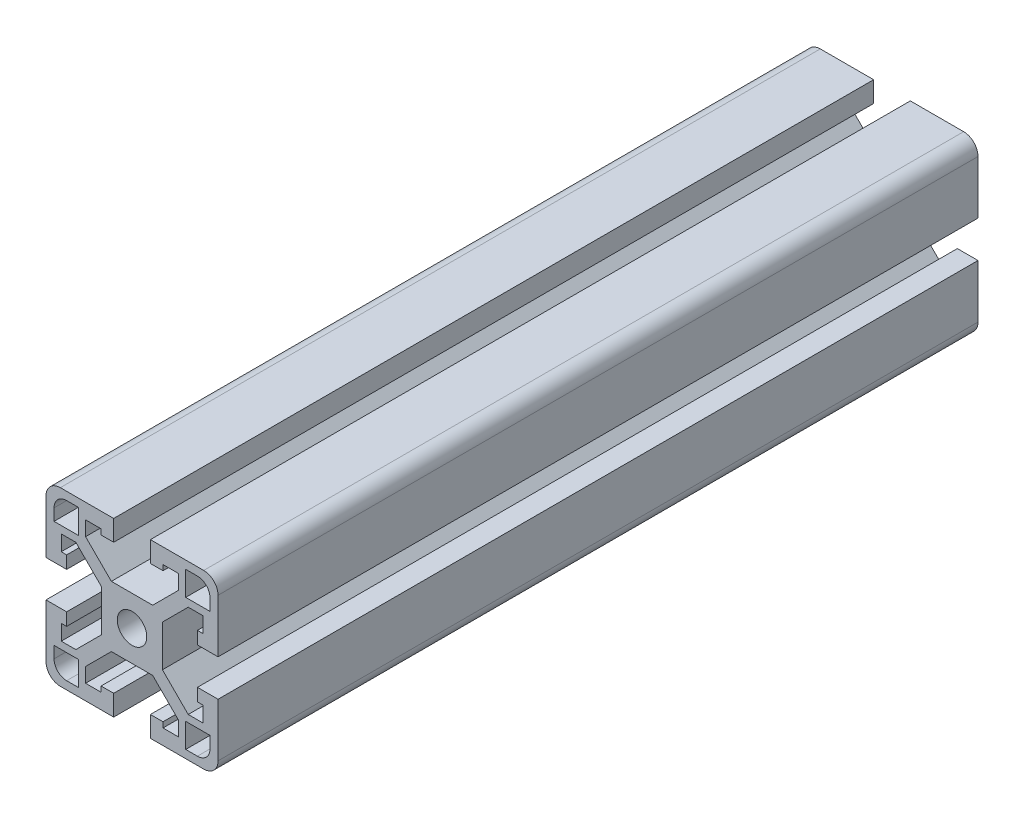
SolidWorks part; units mm, degrees
ref_plane "Front" through (0, 0, 0) normal (0, 0, 1) x (1, 0, 0)
ref_plane "Top" through (0, 0, 0) normal (0, 1, 0) x (1, 0, 0)
ref_plane "Right" through (0, 0, 0) normal (1, 0, 0) x (0, 0, -1)
sketch "Sketch1" plane through (0, 0, 0) normal (0, 0, 1) x (1, 0, 0)
  line L0 (-11.8872, 17.272) -> (-14.478, 17.272)
  line L1 (-11.8872, 11.8872) -> (-11.8872, 17.272)
  line L2 (-17.272, 11.8872) -> (-11.8872, 11.8872)
  line L3 (-17.272, 14.478) -> (-17.272, 11.8872)
  line L4 (14.478, 17.272) -> (11.8872, 17.272)
  line L5 (17.272, 11.8872) -> (17.272, 14.478)
  line L6 (11.8872, 11.8872) -> (17.272, 11.8872)
  line L7 (11.8872, 17.272) -> (11.8872, 11.8872)
  line L8 (11.8872, -17.272) -> (14.478, -17.272)
  line L9 (11.8872, -11.8872) -> (11.8872, -17.272)
  line L10 (17.272, -11.8872) -> (11.8872, -11.8872)
  line L11 (17.272, -14.478) -> (17.272, -11.8872)
  line L12 (-14.478, -17.272) -> (-11.8872, -17.272)
  line L13 (-17.272, -11.8872) -> (-17.272, -14.478)
  line L14 (-11.8872, -11.8872) -> (-17.272, -11.8872)
  line L15 (-11.8872, -17.272) -> (-11.8872, -11.8872)
  line L16 (-6.731, 4.5757) -> (-6.731, -4.5757)
  line L17 (-6.731, -4.5757) -> (-12.4423, -10.287)
  line L18 (-12.4423, -10.287) -> (-15.6718, -10.287)
  line L19 (-15.6718, -10.287) -> (-15.6718, -6.858)
  line L20 (-15.6718, -6.858) -> (-14.478, -6.858)
  line L21 (-14.478, -6.858) -> (-14.478, -4.064)
  line L22 (-14.478, -4.064) -> (-19.05, -4.064)
  line L23 (-19.05, -4.064) -> (-19.05, -15.875)
  line L24 (-15.875, -19.05) -> (-4.064, -19.05)
  line L25 (-4.064, -19.05) -> (-4.064, -14.478)
  line L26 (-4.064, -14.478) -> (-6.858, -14.478)
  line L27 (-6.858, -14.478) -> (-6.858, -15.6718)
  line L28 (-6.858, -15.6718) -> (-10.287, -15.6718)
  line L29 (-10.287, -15.6718) -> (-10.287, -12.4423)
  line L30 (-10.287, -12.4423) -> (-4.5757, -6.731)
  line L31 (-4.5757, -6.731) -> (4.5757, -6.731)
  line L32 (4.5757, -6.731) -> (10.287, -12.4423)
  line L33 (10.287, -12.4423) -> (10.287, -15.6718)
  line L34 (10.287, -15.6718) -> (6.858, -15.6718)
  line L35 (6.858, -15.6718) -> (6.858, -14.478)
  line L36 (6.858, -14.478) -> (4.064, -14.478)
  line L37 (4.064, -14.478) -> (4.064, -19.05)
  line L38 (4.064, -19.05) -> (15.875, -19.05)
  line L39 (19.05, -15.875) -> (19.05, -4.064)
  line L40 (19.05, -4.064) -> (14.478, -4.064)
  line L41 (14.478, -4.064) -> (14.478, -6.858)
  line L42 (14.478, -6.858) -> (15.6718, -6.858)
  line L43 (15.6718, -6.858) -> (15.6718, -10.287)
  line L44 (15.6718, -10.287) -> (12.4423, -10.287)
  line L45 (12.4423, -10.287) -> (6.731, -4.5757)
  line L46 (6.731, -4.5757) -> (6.731, 4.5757)
  line L47 (6.731, 4.5757) -> (12.4423, 10.287)
  line L48 (12.4423, 10.287) -> (15.6718, 10.287)
  line L49 (15.6718, 10.287) -> (15.6718, 6.858)
  line L50 (15.6718, 6.858) -> (14.478, 6.858)
  line L51 (14.478, 6.858) -> (14.478, 4.064)
  line L52 (14.478, 4.064) -> (19.05, 4.064)
  line L53 (19.05, 4.064) -> (19.05, 15.875)
  line L54 (15.875, 19.05) -> (4.064, 19.05)
  line L55 (4.064, 19.05) -> (4.064, 14.478)
  line L56 (4.064, 14.478) -> (6.858, 14.478)
  line L57 (6.858, 14.478) -> (6.858, 15.6718)
  line L58 (6.858, 15.6718) -> (10.287, 15.6718)
  line L59 (10.287, 15.6718) -> (10.287, 12.4423)
  line L60 (10.287, 12.4423) -> (4.5757, 6.731)
  line L61 (4.5757, 6.731) -> (-4.5757, 6.731)
  line L62 (-4.5757, 6.731) -> (-10.287, 12.4423)
  line L63 (-10.287, 12.4423) -> (-10.287, 15.6718)
  line L64 (-10.287, 15.6718) -> (-6.858, 15.6718)
  line L65 (-6.858, 15.6718) -> (-6.858, 14.478)
  line L66 (-6.858, 14.478) -> (-4.064, 14.478)
  line L67 (-4.064, 14.478) -> (-4.064, 19.05)
  line L68 (-4.064, 19.05) -> (-15.875, 19.05)
  line L69 (-19.05, 15.875) -> (-19.05, 4.064)
  line L70 (-19.05, 4.064) -> (-14.478, 4.064)
  line L71 (-14.478, 4.064) -> (-14.478, 6.858)
  line L72 (-14.478, 6.858) -> (-15.6718, 6.858)
  line L73 (-15.6718, 6.858) -> (-15.6718, 10.287)
  line L74 (-15.6718, 10.287) -> (-12.4423, 10.287)
  line L75 (-12.4423, 10.287) -> (-6.731, 4.5757)
  circle A0 centre (0, 0) radius 3.2639
  arc A1 (-19.05, -15.875) -> (-15.875, -19.05) centre (-15.875, -15.875) ccw
  arc A2 (15.875, -19.05) -> (19.05, -15.875) centre (15.875, -15.875) ccw
  arc A3 (19.05, 15.875) -> (15.875, 19.05) centre (15.875, 15.875) ccw
  arc A4 (-15.875, 19.05) -> (-19.05, 15.875) centre (-15.875, 15.875) ccw
  arc A5 (-14.478, 17.272) -> (-17.272, 14.478) centre (-14.478, 14.478) ccw
  arc A6 (17.272, 14.478) -> (14.478, 17.272) centre (14.478, 14.478) ccw
  arc A7 (14.478, -17.272) -> (17.272, -14.478) centre (14.478, -14.478) ccw
  arc A8 (-17.272, -14.478) -> (-14.478, -17.272) centre (-14.478, -14.478) ccw
extrude "Boss-Extrude1" add sketch "Sketch1" along normal mid plane 168.275
